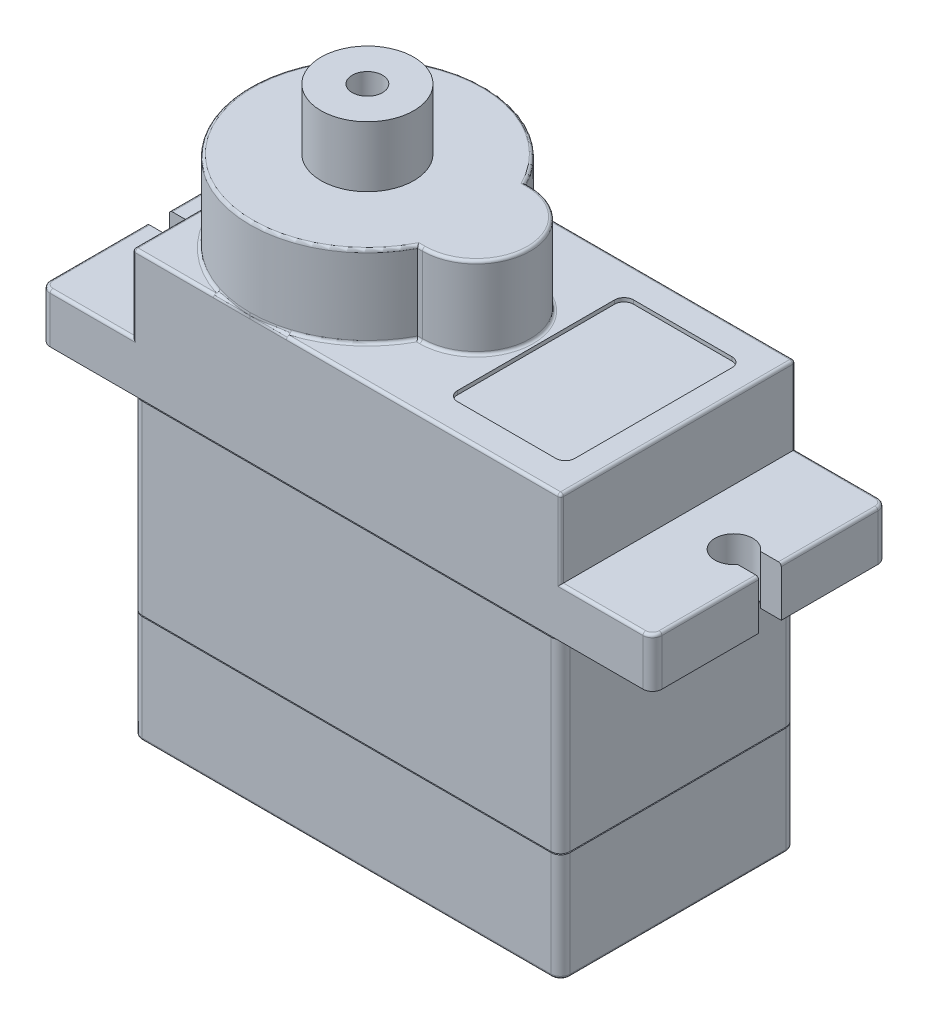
SolidWorks part; units mm, degrees
other "Camera1"
other "Camera2"
other "Camera3"
ref_plane "Front Plane" through (0, 0, 0) normal (0, 0, 1) x (1, 0, 0)
ref_plane "Top Plane" through (0, 0, 0) normal (0, 1, 0) x (1, 0, 0)
ref_plane "Right Plane" through (0, 0, 0) normal (1, 0, 0) x (0, 0, -1)
sketch "Sketch1" plane through (0, 0, 0) normal (0, 1, 0) x (1, 0, 0)
  line L1 (-11.3, -6.2) -> (11.3, -6.2)
  line L2 (-11.3, -6.2) -> (-11.3, 6.2)
  line L3 (-11.3, 6.2) -> (11.3, 6.2)
  line L4 (11.3, -6.2) -> (11.3, 6.2)
  line L5 (-11.3, -6.2) -> (11.3, 6.2) construction
  line L6 (-11.3, 6.2) -> (11.3, -6.2) construction
  point P0 (0, 0)
  dimension "D1" = 12.4
  dimension "D2" = 22.6
extrude "Boss-Extrude1" add sketch "Sketch1" along normal blind 15.6
sketch "Sketch2" plane through (0, 15.6, 0) normal (0, 1, 0) x (1, 0, 0)
  line L0 (11.3, 6.2) -> (-11.3, 6.2) construction
  line L1 (16.15, 6.2) -> (-16.15, 6.2)
  line L2 (-11.3, -6.2) -> (11.3, -6.2) construction
  line L3 (-16.15, -6.2) -> (16.15, -6.2)
  line L4 (-16.15, 6.2) -> (-16.15, -6.2)
  line L5 (0, 6.2) -> (0, -6.2) construction
  line L6 (16.15, 6.2) -> (16.15, -6.2)
  dimension "D1" = 32.3
extrude "Boss-Extrude2" add sketch "Sketch2" along normal blind 2.6
sketch "Sketch3" plane through (0, 18.2, 0) normal (0, 1, 0) x (1, 0, 0)
  line L4 (11.3, -6.2) -> (11.3, 6.2)
  line L5 (-11.3, -6.2) -> (11.3, -6.2)
  line L6 (-11.3, 6.2) -> (-11.3, -6.2)
  line L7 (11.3, 6.2) -> (-11.3, 6.2)
  line L8 (11.3, -6.2) -> (11.3, 6.2)
  line L9 (-11.3, -6.2) -> (11.3, -6.2)
  line L10 (-11.3, 6.2) -> (-11.3, -6.2)
  line L11 (11.3, 6.2) -> (-11.3, 6.2)
  dimension "D1" = 0
extrude "Boss-Extrude3" add sketch "Sketch3" along normal blind 4.1
sketch "Sketch4" plane through (0, 22.3, 0) normal (0, 1, 0) x (1, 0, 0)
  line L0 (-11.3, 0) -> (11.3, 0) construction
  line L1 (-11.3, 6.2) -> (-11.3, -6.2) construction
  line L2 (11.3, -6.2) -> (11.3, 6.2) construction
  line L3 (11.3, 6.2) -> (-11.3, 6.2) construction
  line L4 (0.65, 2.85) -> (0.4061, 2.85)
  line L5 (0.65, -2.85) -> (0.4061, -2.85)
  arc A0 (0.4061, 2.85) -> (0.4061, -2.85) centre (-5.1, 0) ccw
  arc A1 (0.65, -2.85) -> (0.65, 2.85) centre (0.65, 0) ccw
  point P12 (3.5, 0)
  dimension "D2" = 5.7
  dimension "D1" = 14.8
extrude "Boss-Extrude4" add sketch "Sketch4" along normal blind 4.3
sketch "Sketch5" plane through (0, 26.6, 0) normal (0, 1, 0) x (1, 0, 0)
  circle A0 centre (-5.1, 0) radius 2.45
  circle A1 centre (-5.1, 0) radius 0.8
  dimension "D1" = 4.9
  dimension "D2" = 1.6
extrude "Boss-Extrude5" add sketch "Sketch5" along normal blind 3.2
sketch "Sketch6" plane through (0, 18.2, 0) normal (0, 1, 0) x (1, 0, 0)
  line L0 (0, 6.2) -> (0, -6.2) construction
  line L1 (11.3, 6.2) -> (-5.1, 6.2) construction
  line L2 (-5.1, -6.2) -> (11.3, -6.2) construction
  line L3 (-16.15, 6.2) -> (-16.15, -6.2) construction
  line L5 (-16.15, 0) -> (16.15, 0) construction
  line L6 (16.15, -6.2) -> (16.15, 6.2) construction
  line L7 (-16.15, 0.6) -> (-15.05, 0.6)
  line L8 (-16.15, -0.6) -> (-15.05, -0.6)
  line L9 (-16.15, 0.6) -> (-16.15, -0.6)
  line L10 (16.15, 0.6) -> (15.05, 0.6)
  line L11 (16.15, -0.6) -> (15.05, -0.6)
  line L12 (16.15, 0.6) -> (16.15, -0.6)
  arc A0 (-15.05, -0.6) -> (-15.05, 0.6) centre (-14.25, 0) ccw
  arc A1 (15.05, -0.6) -> (15.05, 0.6) centre (14.25, 0) cw
  dimension "D2" = 2
  dimension "D1" = 1.1
  dimension "D3" = 1.2
extrude "Cut-Extrude1" cut sketch "Sketch6" against normal up to surface (2.6 mm away)
sketch "Sketch7" plane through (-11.3, 0, 0) normal (-1, 0, 0) x (0, 0, 1)
  line L0 (0, 0) -> (0, 29.8) construction
  line L1 (-6.2, 0) -> (6.2, 0) construction
  line L2 (2.45, 29.8) -> (-2.45, 29.8) construction
  line L3 (-1.15, 5.1) -> (1.15, 5.1) construction
  line L4 (-1.15, 4.5) -> (1.15, 4.5) construction
  circle A0 centre (-1.15, 5.1) radius 0.6 construction
  circle A1 centre (1.15, 5.1) radius 0.6
  circle A2 centre (0, 5.1) radius 0.6 construction
  point P10 (0, 5.1)
  point P15 (-1.75, 5.1)
  point P16 (1.75, 5.1)
  dimension "D2" = 1.2
  dimension "D1" = 4.5
  dimension "D3" = 3.5
sketch "Sketch8" plane through (0, 15.6, 0) normal (0, -1, 0) x (1, 0, 0)
  line L0 (0, 6.2) -> (0, -6.2) construction
  line L1 (-11.3, 6.2) -> (11.3, 6.2) construction
  line L2 (11.3, -6.2) -> (-11.3, -6.2) construction
  line L3 (15.15, -1.7861) -> (15.15, -1.7861)
  line L4 (15.15, -5.2) -> (15.15, -1.7861)
  line L5 (11.3, -5.2) -> (15.15, -5.2)
  line L7 (15.15, 5.2) -> (12.3, 5.2) construction
  line L8 (15.15, 5.2) -> (11.3, 5.2)
  line L9 (15.15, 1.7861) -> (15.15, 5.2)
  line L10 (15.15, 1.7861) -> (15.15, 1.7861)
  line L11 (15.05, 0.6) -> (16.15, 0.6)
  line L12 (16.15, 0.6) -> (16.15, 6.2)
  line L13 (16.15, 6.2) -> (11.3, 6.2)
  line L14 (11.3, 6.2) -> (11.3, -6.2)
  line L15 (11.3, -6.2) -> (16.15, -6.2)
  line L16 (16.15, -6.2) -> (16.15, -0.6)
  line L24 (16.15, -0.6) -> (15.05, -0.6)
  line L25 (15.05, 0.6) -> (16.15, 0.6) construction
  line L26 (16.15, 0.6) -> (16.15, 6.2) construction
  line L27 (16.15, 6.2) -> (11.3, 6.2) construction
  line L28 (11.3, 5.2) -> (11.3, -5.2)
  line L29 (11.3, -6.2) -> (16.15, -6.2) construction
  line L30 (16.15, -6.2) -> (16.15, -0.6) construction
  line L31 (16.15, -0.6) -> (15.05, -0.6) construction
  line L32 (12.3, 5.2) -> (12.3, -5.2) construction
  line L33 (12.3, -5.2) -> (15.15, -5.2) construction
  line L34 (11.3, 6.2) -> (11.3, -6.2) construction
  line L35 (-11.3, -5.2) -> (-15.15, -5.2)
  line L36 (-15.15, -5.2) -> (-15.15, -1.7861)
  line L37 (-11.3, 5.2) -> (-11.3, -5.2)
  line L38 (-15.15, 1.7861) -> (-15.15, 5.2)
  line L39 (-15.15, 5.2) -> (-11.3, 5.2)
  arc A1 (15.15, 1.7861) -> (15.15, -1.7861) centre (14.25, 0) ccw
  arc A3 (15.05, 0.6) -> (15.05, -0.6) centre (14.25, 0) ccw
  arc A4 (15.05, 0.6) -> (15.05, -0.6) centre (14.25, 0) ccw construction
  arc A5 (-15.15, 1.7861) -> (-15.15, -1.7861) centre (-14.25, 0) cw
  dimension "D2" = 1
  dimension "D1" = 0
extrude "Cut-Extrude2" cut sketch "Sketch8" against normal blind 1
sketch "Sketch9" plane through (0, 22.3, 0) normal (0, 1, 0) x (1, 0, 0)
  line L0 (11.3, 0) -> (-11.3, 0) construction
  line L1 (11.3, -6.2) -> (11.3, 6.2) construction
  line L2 (-11.3, 6.2) -> (-11.3, -6.2) construction
  line L3 (10, 4.15) -> (10, -4.15)
  line L4 (9.5, 4.65) -> (4.3, 4.65)
  line L5 (3.8, 4.15) -> (3.8, -4.15)
  line L6 (4.3, -4.65) -> (9.5, -4.65)
  line L7 (11.3, -6.2) -> (11.3, 6.2) construction
  arc A0 (10, -4.15) -> (9.5, -4.65) centre (9.5, -4.15) cw
  arc A1 (3.8, -4.15) -> (4.3, -4.65) centre (4.3, -4.15) ccw
  arc A2 (4.3, 4.65) -> (3.8, 4.15) centre (4.3, 4.15) ccw
  arc A3 (10, 4.15) -> (9.5, 4.65) centre (9.5, 4.15) ccw
  point P8 (10, 0)
  point P15 (10, -4.65)
  point P20 (3.8, 4.65)
  point P23 (10, 4.65)
  dimension "D4" = 0.5
  dimension "D1" = 9.3
  dimension "D2" = 6.2
  dimension "D3" = 1.3
extrude "Cut-Extrude3" cut sketch "Sketch9" against normal blind 0.2
fillet "Fillet1" radius 0.5 8 edges at (16.15, 16.9, 6.2) (-16.15, 16.9, 6.2) (-16.15, 16.9, -6.2) (16.15, 16.9, -6.2) (11.3, 7.8, 6.2) (11.3, 7.8, -6.2) (-11.3, 7.8, -6.2) (-11.3, 7.8, 6.2)
fillet "Fillet2" radius 0.15 42 edges at (16.15, 18.2, 3.15) (0, 0, 6.2) (-13.475, 18.2, 6.2) (13.475, 18.2, -6.2) (16.0036, 18.2, -6.0536) (16.0036, 18.2, 6.0536) (-16.15, 18.2, -3.15) (-16.0036, 18.2, -6.0536) (-16.0036, 18.2, 6.0536) (0, 0, -6.2) (11.3, 0, 0) (-11.3, 0, 0) (-11.1536, 0, 6.0536) (-11.1536, 0, -6.0536) (11.1536, 0, -6.0536) (11.1536, 0, 6.0536) (13.475, 18.2, 6.2) (-13.475, 18.2, -6.2) (11.3, 20.25, -6.2) (-11.3, 20.25, -6.2) (-11.3, 20.25, 6.2) (11.3, 20.25, 6.2) (3.1, 22.3, -6.2) (-11.3, 22.3, -3.1) (-8.2, 22.3, 6.2) (11.3, 22.3, 0) (-8.2, 22.3, -6.2) (-11.3, 22.3, 3.1) (3.1, 22.3, 6.2) (-9.4841, 22.3, -4.3841) (-1.8774, 22.3, 5.2967) (-9.4841, 22.3, 4.3841) (3.5, 22.3, 0) (0.5281, 22.3, -2.85) (-1.8774, 22.3, -5.2967) (0.5281, 22.3, 2.85) (3.5, 26.6, 0) (0.5281, 26.6, -2.85) (-11.3, 26.6, 0) (0.5281, 26.6, 2.85) (-16.15, 18.2, 3.15) (16.15, 18.2, -3.15)
sketch "Sketch10" plane through (0, 15.6, 0) normal (0, -1, 0) x (1, 0, 0)
  line L0 (-10.8, 6.2) -> (10.8, 6.2) construction
  line L1 (-10.8, 6.2) -> (10.8, 6.2)
  line L2 (11.3, 5.7) -> (11.3, 5.2) construction
  line L3 (11.3, 5.7) -> (11.3, 5.2)
  line L4 (11.3, 5.2) -> (11.3, -5.2) construction
  line L5 (11.3, 5.2) -> (11.3, -5.2)
  line L6 (11.3, -5.2) -> (11.3, -5.7) construction
  line L7 (11.3, -5.2) -> (11.3, -5.7)
  line L9 (10.8, -6.2) -> (-10.8, -6.2) construction
  line L10 (10.8, -6.2) -> (-10.8, -6.2)
  line L11 (-11.3, -5.7) -> (-11.3, 5.7) construction
  line L12 (-11.3, -5.7) -> (-11.3, 5.7)
  line L13 (-11.1, -5.7) -> (-11.1, 5.7)
  line L14 (-10.8, 6) -> (10.8, 6)
  line L15 (11.1, 5.7) -> (11.1, 5.2)
  line L16 (11.1, 5.2) -> (11.1, -5.2)
  line L17 (11.1, -5.2) -> (11.1, -5.7)
  line L18 (10.8, -6) -> (-10.8, -6)
  arc A0 (11.3, 5.7) -> (10.8, 6.2) centre (10.8, 5.7) ccw construction
  arc A1 (11.3, 5.7) -> (10.8, 6.2) centre (10.8, 5.7) ccw
  arc A2 (10.8, -6.2) -> (11.3, -5.7) centre (10.8, -5.7) ccw construction
  arc A3 (10.8, -6.2) -> (11.3, -5.7) centre (10.8, -5.7) ccw
  arc A4 (-11.3, -5.7) -> (-10.8, -6.2) centre (-10.8, -5.7) ccw construction
  arc A5 (-11.3, -5.7) -> (-10.8, -6.2) centre (-10.8, -5.7) ccw
  arc A6 (-10.8, 6.2) -> (-11.3, 5.7) centre (-10.8, 5.7) ccw construction
  arc A7 (-10.8, 6.2) -> (-11.3, 5.7) centre (-10.8, 5.7) ccw
  arc A8 (-10.8, 6) -> (-11.1, 5.7) centre (-10.8, 5.7) ccw
  arc A9 (11.1, 5.7) -> (10.8, 6) centre (10.8, 5.7) ccw
  arc A10 (10.8, -6) -> (11.1, -5.7) centre (10.8, -5.7) ccw
  arc A11 (-11.1, -5.7) -> (-10.8, -6) centre (-10.8, -5.7) ccw
  dimension "D1" = 0.2
extrude "Cut-Extrude4" cut sketch "Sketch10" along normal blind 0.05
ref_plane "Plane1" through (0, 5.7, 0) normal (0, -1, 0) x (-1, 0, 0)
sketch "Sketch11" plane through (0, 5.7, 0) normal (0, -1, 0) x (-1, 0, 0)
  line L0 (-11.1, 5.7) -> (-11.1, -5.7)
  line L1 (-10.8, -6) -> (10.8, -6)
  line L2 (11.1, -5.7) -> (11.1, 5.7)
  line L3 (10.8, 6) -> (-10.8, 6)
  line L4 (-11.3, 5.7) -> (-11.3, -5.7)
  line L5 (10.8, 6.2) -> (-10.8, 6.2)
  line L6 (11.3, -5.7) -> (11.3, 5.7)
  line L7 (-10.8, -6.2) -> (10.8, -6.2)
  line L8 (-11.3, 5.7) -> (-11.3, -5.7)
  line L9 (10.8, 6.2) -> (-10.8, 6.2)
  line L10 (11.3, -5.7) -> (11.3, 5.7)
  line L11 (-10.8, -6.2) -> (10.8, -6.2)
  arc A0 (-11.1, -5.7) -> (-10.8, -6) centre (-10.8, -5.7) ccw
  arc A1 (10.8, -6) -> (11.1, -5.7) centre (10.8, -5.7) ccw
  arc A2 (11.1, 5.7) -> (10.8, 6) centre (10.8, 5.7) ccw
  arc A3 (-10.8, 6) -> (-11.1, 5.7) centre (-10.8, 5.7) ccw
  arc A4 (-11.3, -5.7) -> (-10.8, -6.2) centre (-10.8, -5.7) ccw
  arc A5 (-10.8, 6.2) -> (-11.3, 5.7) centre (-10.8, 5.7) ccw
  arc A6 (11.3, 5.7) -> (10.8, 6.2) centre (10.8, 5.7) ccw
  arc A7 (10.8, -6.2) -> (11.3, -5.7) centre (10.8, -5.7) ccw
  arc A8 (-11.3, -5.7) -> (-10.8, -6.2) centre (-10.8, -5.7) ccw
  arc A9 (-10.8, 6.2) -> (-11.3, 5.7) centre (-10.8, 5.7) ccw
  arc A10 (11.3, 5.7) -> (10.8, 6.2) centre (10.8, 5.7) ccw
  arc A11 (10.8, -6.2) -> (11.3, -5.7) centre (10.8, -5.7) ccw
  dimension "D1" = 0
  dimension "D2" = 0.2
extrude "Cut-Extrude5" cut sketch "Sketch11" against normal blind 0.05
extrude "Boss-Extrude9" add sketch "Sketch7" along normal blind 2
sketch "Sketch12" plane through (-11.3, 0, 0) normal (-1, 0, 0) x (0, 0, 1)
  circle A0 centre (0, 5.1) radius 0.6 construction
  circle A1 centre (0, 5.1) radius 0.6
extrude "Boss-Extrude10" add sketch "Sketch12" along normal blind 2
sketch "Sketch13" plane through (-11.3, 0, 0) normal (-1, 0, 0) x (0, 0, 1)
  circle A0 centre (-1.15, 5.1) radius 0.6 construction
  circle A1 centre (-1.15, 5.1) radius 0.6
extrude "Boss-Extrude11" add sketch "Sketch13" along normal blind 2
